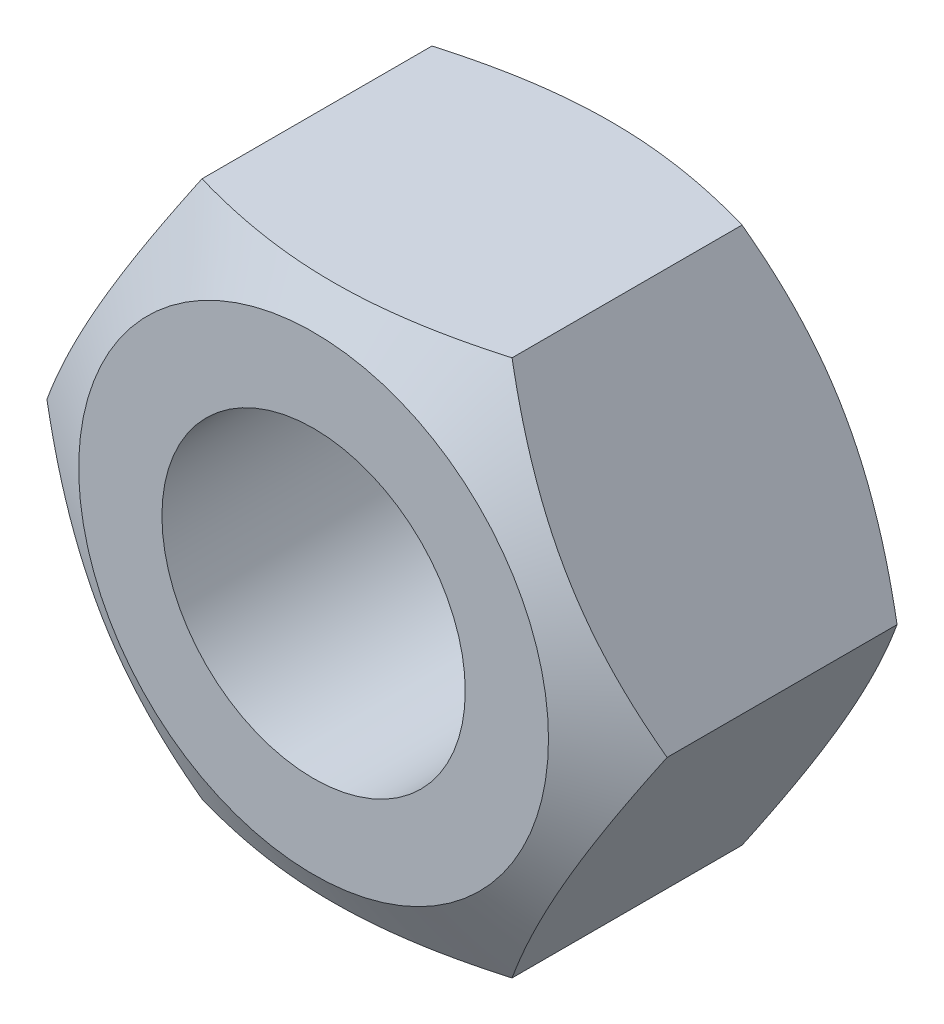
SolidWorks part; units mm, degrees
ref_plane "Plan de face" through (0, 0, 0) normal (0, 0, 1) x (1, 0, 0)
ref_plane "Plan de dessus" through (0, 0, 0) normal (0, 1, 0) x (1, 0, 0)
ref_plane "Plan de droite" through (0, 0, 0) normal (1, 0, 0) x (0, 0, -1)
sketch "Esquisse1" plane through (0, 0, 0) normal (0, 0, 1) x (1, 0, 0)
  circle A0 centre (0, 0) radius 4.6
  circle A1 centre (0, 0) radius 2.25
  dimension "D1" = 4.5
  dimension "D2" = 9.2
extrude "Boss.-Extru.1" add sketch "Esquisse1" along normal blind 4.7
chamfer "Chanfrein1" distance 0.644 angle 60 2 edges at (4.6, 0, 0) (4.6, 0, 4.7)
sketch "Esquisse2" plane through (0, 0, 4.7) normal (0, 0, 1) x (1, 0, 0)
  line L1 (4.6, 0) -> (2.3, 3.9837)
  line L2 (2.3, 3.9837) -> (-2.3, 3.9837)
  line L3 (-2.3, 3.9837) -> (-4.6, 0)
  line L4 (-4.6, 0) -> (-2.3, -3.9837)
  line L5 (-2.3, -3.9837) -> (2.3, -3.9837)
  line L6 (2.3, -3.9837) -> (4.6, 0)
  circle A0 centre (0, 0) radius 3.9837 construction
extrude "Enlèv. mat.-Extru.1" cut sketch "Esquisse2" against normal blind 4.7 flip side to cut
